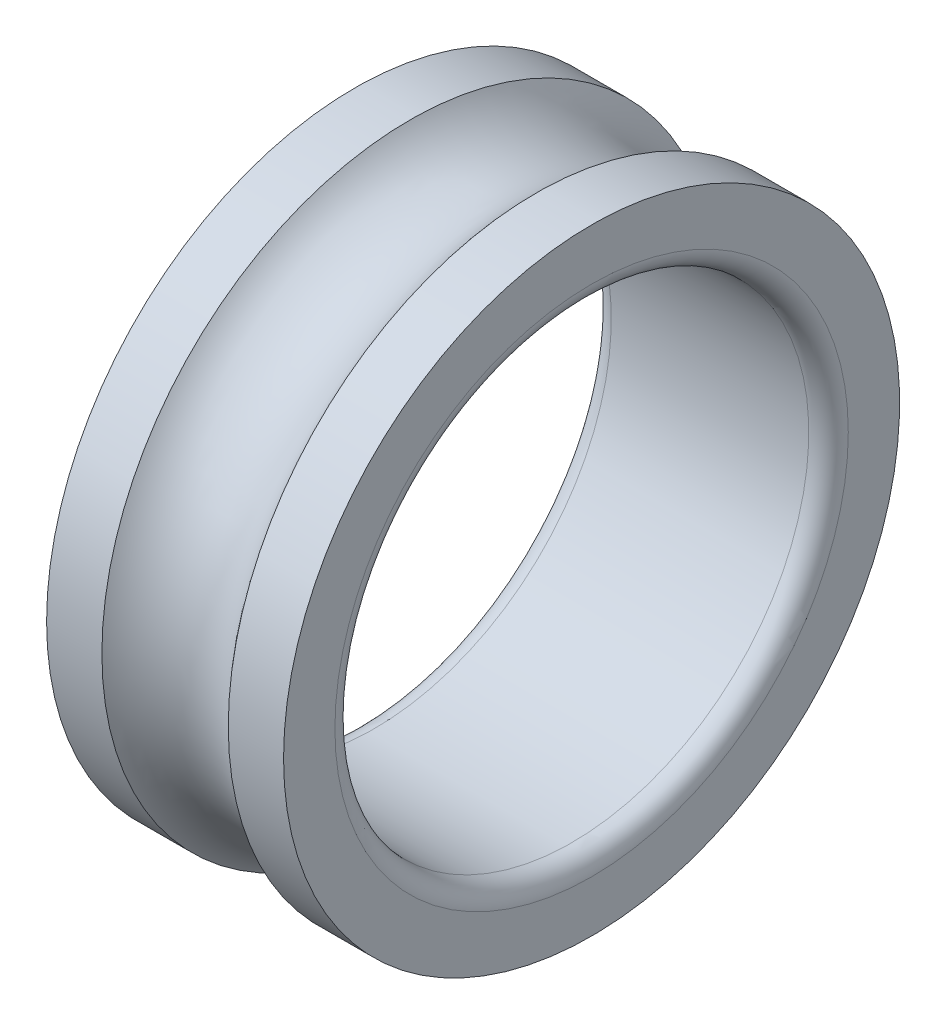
SolidWorks part; units mm, degrees
ref_plane "Face" through (0, 0, 0) normal (0, 0, 1) x (1, 0, 0)
ref_plane "Dessus" through (0, 0, 0) normal (0, 1, 0) x (1, 0, 0)
ref_plane "Droite" through (0, 0, 0) normal (1, 0, 0) x (0, 0, -1)
sketch "Esquisse1" plane through (0, 0, 0) normal (0, 0, 1) x (1, 0, 0)
  line L5 (-4.3709, 0) -> (4.0553, 0) construction
  line L7 (3, 6.5) -> (3, 7.8)
  line L8 (-3, 7.8) -> (-1.6, 7.8)
  line L9 (-3, 6.5) -> (-3, 7.8)
  line L10 (-2.5, 6) -> (2.5, 6)
  line L11 (1.6, 7.8) -> (3, 7.8)
  arc A0 (3, 6.5) -> (2.5, 6) centre (2.5, 6.5) cw
  arc A3 (-3, 6.5) -> (-2.5, 6) centre (-2.5, 6.5) ccw
  arc A5 (1.6, 7.8) -> (-1.6, 7.8) centre (0, 9) cw
  dimension "D6" = 1.8
  dimension "D7" = 2
  dimension "D3" = 0.5
  dimension "D1" = 6
  dimension "D2" = 3
  dimension "D4" = 6
  dimension "D5" = 9
revolve "Base-Révolution" add sketch "Esquisse1" angle 360 about L5
